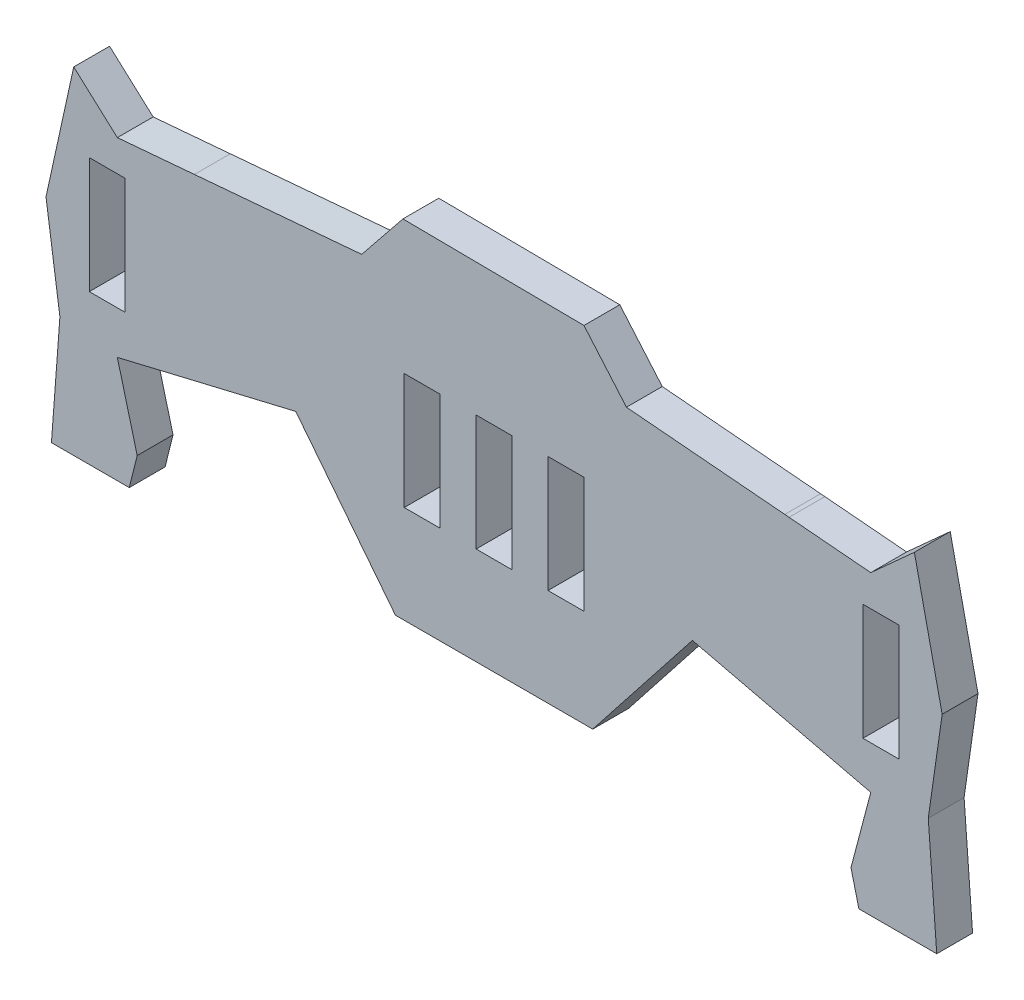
SolidWorks part; units mm, degrees
ref_plane "Alzado" through (0, 0, 0) normal (0, 0, 1) x (1, 0, 0)
ref_plane "Planta" through (0, 0, 0) normal (0, 1, 0) x (1, 0, 0)
ref_plane "Vista lateral" through (0, 0, 0) normal (1, 0, 0) x (0, 0, -1)
sketch "Croquis2" plane through (0, 0, 0) normal (0, 0, 1) x (1, 0, 0)
sketch_block_instance "F1 CAR CUT corte-1"
sketch_block "Bloque1"
extrude "Saliente-Extruir1" add sketch "Croquis2" along normal blind 3
delete or keep bodies "Sólido-Eliminar/Conservar 27" type delete bodies bodies 109 105 110 106 111 107
delete or keep bodies "Sólido-Eliminar/Conservar 33" type delete bodies bodies 102 101 103 108
delete or keep bodies "Sólido-Eliminar/Conservar 38" type delete bodies bodies 113
delete or keep bodies "Sólido-Eliminar/Conservar 39" type delete bodies bodies 112
delete or keep bodies "Sólido-Eliminar/Conservar 40" type delete bodies bodies 114
